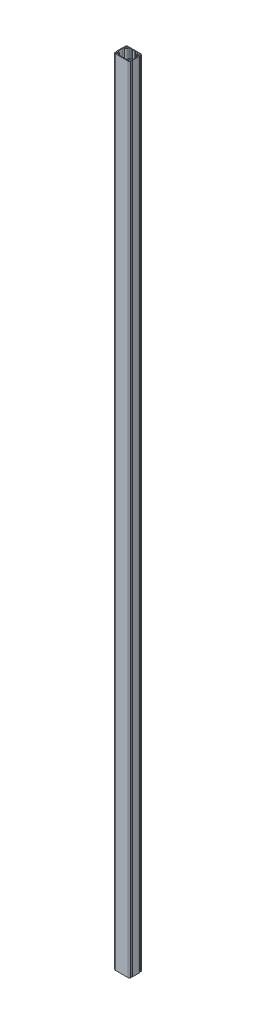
SolidWorks part; units mm, degrees
ref_plane "Alzado" through (0, 0, 0) normal (0, 0, 1) x (1, 0, 0)
ref_plane "Planta" through (0, 0, 0) normal (0, 1, 0) x (1, 0, 0)
ref_plane "Vista lateral" through (0, 0, 0) normal (1, 0, 0) x (0, 0, -1)
sketch "Croquis1" plane through (0, 0, 0) normal (0, 1, 0) x (1, 0, 0)
  line L0 (0, -75.4262) -> (0, 70.5479) construction
  line L1 (-123.9156, -11.6543) -> (129.4204, -11.6543) construction
  line L6 (39.5, 1.486) -> (39.5, 34.9397) construction
  line L7 (19.5039, 17.8457) -> (63.5704, 17.8457) construction
  line L9 (46, -42.8837) -> (46, -42.6992)
  line L10 (22.5, 24.3457) -> (12.5, 24.3457)
  line L12 (39.5, 17.8457) -> (50.0765, 20.3595) construction
  line L13 (47.3463, 21.5924) -> (48.0388, 18.6787) construction
  line L14 (47.3463, -44.9011) -> (48.0388, -41.9874) construction
  line L15 (39.5, -41.1543) -> (50.0765, -43.6682) construction
  line L16 (19.5039, -41.1543) -> (63.5704, -41.1543) construction
  line L17 (39.5, -24.7947) -> (39.5, -58.2483) construction
  line L19 (46, 19.5751) -> (46, 19.3906)
  line L20 (39.5, -51.6543) -> (-39.5, -51.6543)
  line L21 (11, 22.8457) -> (12.5, 24.3457)
  line L22 (46, -24.1543) -> (46, 0.8457)
  line L23 (50, -31.9348) -> (50, 8.6261)
  line L24 (-39.5, -24.7947) -> (-39.5, -58.2483) construction
  line L25 (-19.5039, -41.1543) -> (-63.5704, -41.1543) construction
  line L26 (-39.5, -41.1543) -> (-50.0765, -43.6682) construction
  line L27 (-47.3463, -44.9011) -> (-48.0388, -41.9874) construction
  line L28 (-47.3463, 21.5924) -> (-48.0388, 18.6787) construction
  line L29 (-39.5, 17.8457) -> (-50.0765, 20.3595) construction
  line L30 (-19.5039, 17.8457) -> (-63.5704, 17.8457) construction
  line L31 (-39.5, 1.486) -> (-39.5, 34.9397) construction
  line L32 (123.9156, -11.6543) -> (-129.4204, -11.6543) construction
  line L33 (-50, -31.9348) -> (-50, 8.6261)
  line L34 (-46, -24.1543) -> (-46, 0.8457)
  line L35 (-50, 28.3457) -> (-50, -31.9348)
  line L36 (-39.5, -51.6543) -> (39.5, -51.6543)
  line L38 (-22.5, -47.6543) -> (-12.5, -47.6543)
  line L39 (-22.5, 24.3457) -> (-12.5, 24.3457)
  line L40 (-46, -42.8837) -> (-46, -42.6992)
  line L41 (-39.5, 28.3457) -> (39.5, 28.3457)
  line L42 (46, 0.8457) -> (46, -24.1543)
  line L43 (50, 8.6261) -> (50, -31.9348)
  line L44 (8, 22.8457) -> (6.5, 24.3457)
  line L45 (11, 22.8457) -> (8, 22.8457)
  line L46 (-11, 22.8457) -> (-8, 22.8457)
  line L47 (-8, 22.8457) -> (-6.5, 24.3457)
  line L48 (-11, 22.8457) -> (-12.5, 24.3457)
  line L49 (11, -46.1543) -> (8, -46.1543)
  line L50 (8, -46.1543) -> (6.5, -47.6543)
  line L51 (11, -46.1543) -> (12.5, -47.6543)
  line L52 (-11, -46.1543) -> (-12.5, -47.6543)
  line L53 (-8, -46.1543) -> (-6.5, -47.6543)
  line L54 (-11, -46.1543) -> (-8, -46.1543)
  line L55 (-6.5, -47.6543) -> (6.5, -47.6543)
  line L56 (12.5, -47.6543) -> (22.5, -47.6543)
  line L57 (-12.5, 24.3457) -> (-22.5, 24.3457)
  line L58 (6.5, 24.3457) -> (-6.5, 24.3457)
  line L59 (-6.5, 24.3457) -> (6.5, 24.3457)
  line L60 (12.5, 24.3457) -> (22.5, 24.3457)
  line L61 (-46, 0.8457) -> (-46, -24.1543)
  arc A0 (49.242, 21.7627) -> (39.5, 28.3457) centre (39.5, 17.8457) ccw
  arc A1 (45.5308, 20.2705) -> (43.0455, 12.3978) centre (39.5, 17.8457) ccw
  arc A5 (45.5308, 20.2705) -> (49.242, 21.7627) centre (47.3864, 21.0166) ccw
  arc A6 (29, 17.8457) -> (22.5, 24.3457) centre (22.5, 17.8457) ccw
  arc A7 (46, 0.8457) -> (39.5, 7.3457) centre (39.5, 0.8457) ccw
  arc A9 (50, 8.6261) -> (43.0455, 12.3978) centre (45.5, 8.6261) ccw
  arc A10 (50, -31.9348) -> (43.0455, -35.7064) centre (45.5, -31.9348) cw
  arc A11 (46, -24.1543) -> (39.5, -30.6543) centre (39.5, -24.1543) cw
  arc A12 (29, -41.1543) -> (22.5, -47.6543) centre (22.5, -41.1543) cw
  arc A13 (45.5308, -43.5791) -> (49.242, -45.0713) centre (47.3864, -44.3252) cw
  arc A14 (45.5308, -43.5791) -> (43.0455, -35.7064) centre (39.5, -41.1543) cw
  arc A15 (49.242, -45.0713) -> (39.5, -51.6543) centre (39.5, -41.1543) cw
  arc A16 (29, -41.1543) -> (39.5, -30.6543) centre (39.5, -41.1543) cw
  arc A17 (29, 17.8457) -> (39.5, 7.3457) centre (39.5, 17.8457) ccw
  arc A18 (-29, 17.8457) -> (-39.5, 7.3457) centre (-39.5, 17.8457) cw
  arc A19 (-29, -41.1543) -> (-39.5, -30.6543) centre (-39.5, -41.1543) ccw
  arc A20 (-49.242, -45.0713) -> (-39.5, -51.6543) centre (-39.5, -41.1543) ccw
  arc A21 (-45.5308, -43.5791) -> (-43.0455, -35.7064) centre (-39.5, -41.1543) ccw
  arc A22 (-45.5308, -43.5791) -> (-49.242, -45.0713) centre (-47.3864, -44.3252) ccw
  arc A23 (-29, -41.1543) -> (-22.5, -47.6543) centre (-22.5, -41.1543) ccw
  arc A24 (-46, -24.1543) -> (-39.5, -30.6543) centre (-39.5, -24.1543) ccw
  arc A25 (-50, -31.9348) -> (-43.0455, -35.7064) centre (-45.5, -31.9348) ccw
  arc A26 (-50, 8.6261) -> (-43.0455, 12.3978) centre (-45.5, 8.6261) cw
  arc A27 (-46, 0.8457) -> (-39.5, 7.3457) centre (-39.5, 0.8457) cw
  arc A28 (-29, 17.8457) -> (-22.5, 24.3457) centre (-22.5, 17.8457) cw
  arc A29 (-45.5308, 20.2705) -> (-49.242, 21.7627) centre (-47.3864, 21.0166) cw
  arc A30 (-45.5308, 20.2705) -> (-43.0455, 12.3978) centre (-39.5, 17.8457) cw
  arc A31 (-49.242, 21.7627) -> (-39.5, 28.3457) centre (-39.5, 17.8457) cw
  dimension "D8" = 2
  dimension "D9" = 13
  dimension "D12" = 4.5
  dimension "D2" = 8
  dimension "D3" = 11.6543
  dimension "D4" = 3
  dimension "D5" = 45
  dimension "D6" = 45
  dimension "D10" = 13.37
  dimension "D11" = 8.5
  dimension "D13" = 3.1709
  dimension "D14" = 9.2195
extrude "Saliente-Extruir1" add sketch "Croquis1" along normal blind 5000 contours A31 A29 A30 A26 L33 A25 A21 A22 A20 L20 A15 A13 A14 A10 L23 A9 A1 A5 A0 L41 A18 A28 L39 L48 L46 L47 L58 L44 L45 L21 L10 A6 A17 A7 L22 A11 A16 A12 L56 L51 L49 L50 L55 L53 L54 L52 L38
